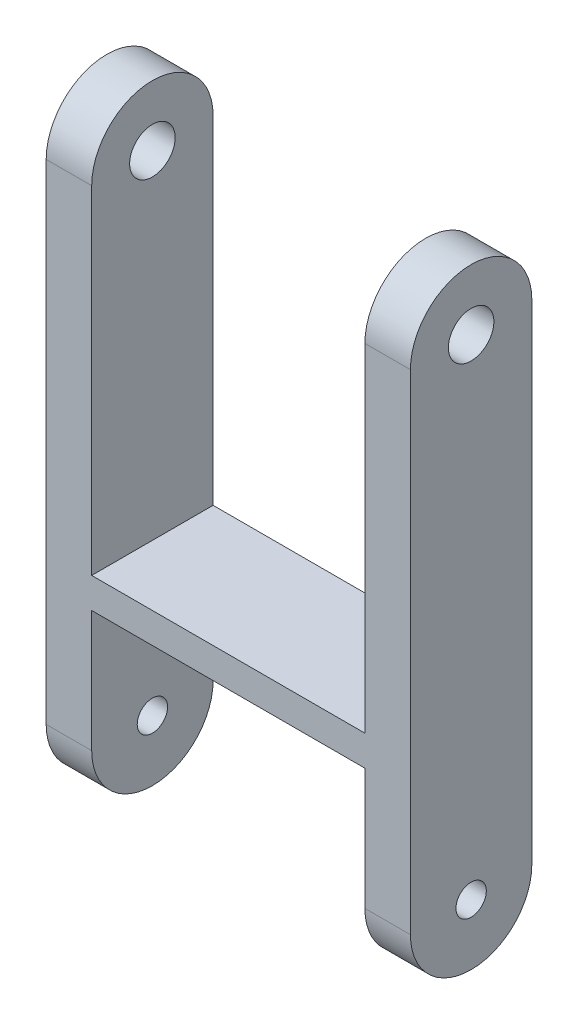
SolidWorks part; units mm, degrees
ref_plane "Front Plane" through (0, 0, 0) normal (0, 0, 1) x (1, 0, 0)
ref_plane "Top Plane" through (0, 0, 0) normal (0, 1, 0) x (1, 0, 0)
ref_plane "Right Plane" through (0, 0, 0) normal (1, 0, 0) x (0, 0, -1)
sketch "Sketch1" plane through (0, 0, 0) normal (1, 0, 0) x (0, 0, -1)
  line L0 (0, 102.3582) -> (0, -102.3582) construction
  line L1 (-25.4, 102.3582) -> (-25.4, -102.3582)
  line L2 (25.4, 102.3582) -> (25.4, -102.3582)
  arc A0 (-25.4, 102.3582) -> (25.4, 102.3582) centre (0, 102.3582) cw
  arc A1 (-25.4, -102.3582) -> (25.4, -102.3582) centre (0, -102.3582) ccw
  circle A2 centre (0, 102.3582) radius 9.525
  circle A3 centre (0, -102.3582) radius 6.35
  dimension "D3" = 12.7
  dimension "D4" = 19.05
  dimension "D1" = 25.4
  dimension "D2" = 25.4
extrude "Extrude1" add sketch "Sketch1" along normal mid plane 152.4
sketch "Sketch2" plane through (0, 0, 25.4) normal (0, 0, 1) x (1, 0, 0)
  line L0 (76.2, 127.7582) -> (-76.2, 127.7582) construction
  line L1 (57.15, 127.7582) -> (-57.15, 127.7582)
  line L2 (57.15, 127.7582) -> (57.15, -38.8582)
  line L3 (57.15, -38.8582) -> (-57.15, -38.8582)
  line L4 (-57.15, 127.7582) -> (-57.15, -38.8582)
  line L5 (-76.2, -127.7582) -> (76.2, -127.7582) construction
  line L6 (57.15, -127.7582) -> (-57.15, -127.7582)
  line L7 (57.15, -127.7582) -> (57.15, -51.5582)
  line L8 (57.15, -51.5582) -> (-57.15, -51.5582)
  line L9 (-57.15, -127.7582) -> (-57.15, -51.5582)
  line L10 (0, 0) -> (0, -38.8582) construction
  line L11 (76.2, 102.3582) -> (76.2, 127.7582) construction
  point P14 (-18.1053, 141.9536)
  dimension "D1" = 12.7
  dimension "D2" = 19.05
  dimension "D3" = 76.2
extrude "Cut-Extrude1" cut sketch "Sketch2" against normal through all
